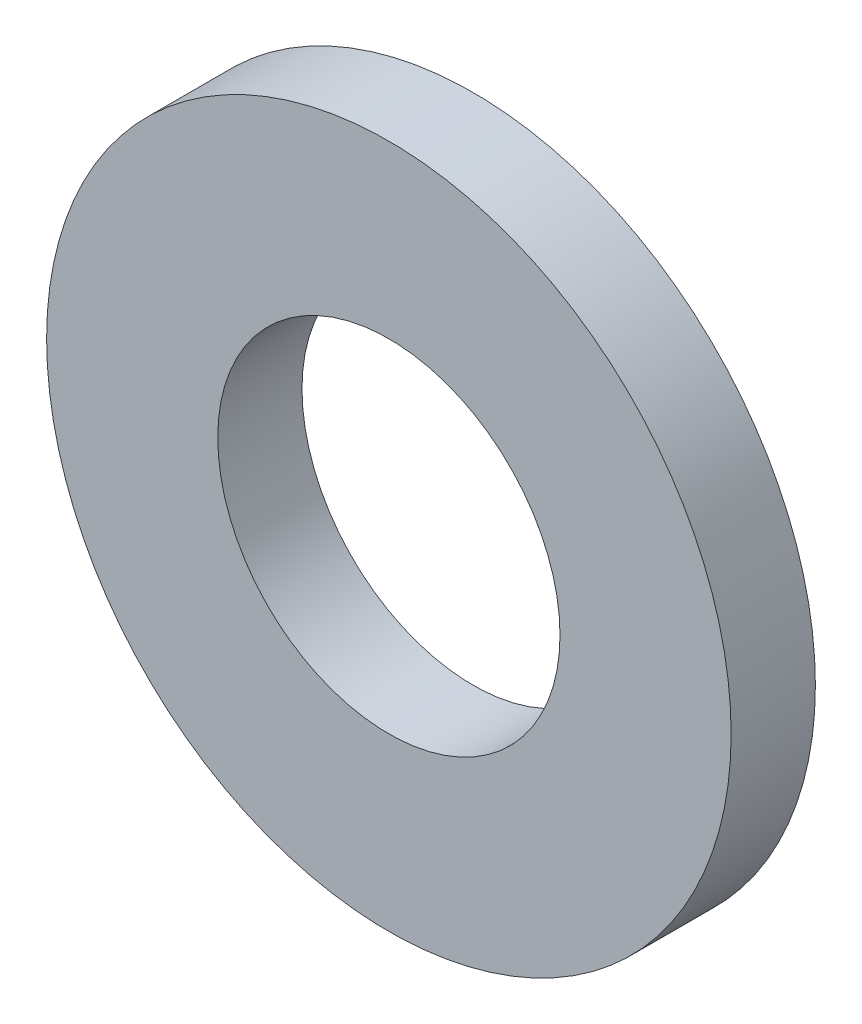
SolidWorks part; units mm, degrees
ref_plane "FACE" through (0, 0, 0) normal (0, 0, 1) x (1, 0, 0)
ref_plane "DESSUS" through (0, 0, 0) normal (0, 1, 0) x (1, 0, 0)
ref_plane "GAUCHE" through (0, 0, 0) normal (1, 0, 0) x (0, 0, -1)
sketch "Esquisse1" plane through (0, 0, 0) normal (0, 0, 1) x (1, 0, 0)
  circle A0 centre (0, 0) radius 1.625
  circle A1 centre (0, 0) radius 3.25
  dimension "D1" = 3.25
  dimension "D2" = 6.5
extrude "Base-Extrusion" add sketch "Esquisse1" along normal blind 0.8
